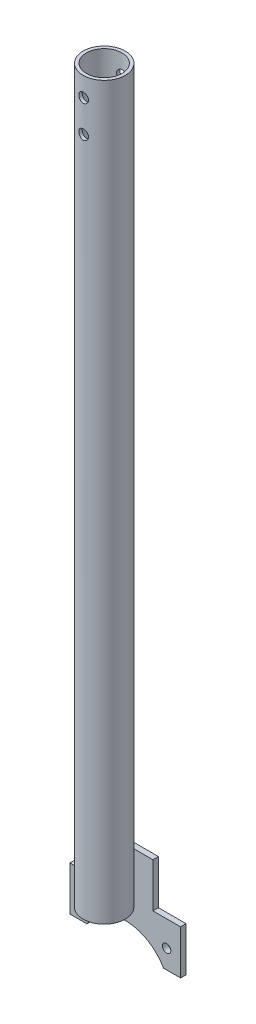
SolidWorks part; units mm, degrees
ref_plane "Front Plane" through (0, 0, 0) normal (0, 0, 1) x (1, 0, 0)
ref_plane "Top Plane" through (0, 0, 0) normal (0, 1, 0) x (1, 0, 0)
ref_plane "Right Plane" through (0, 0, 0) normal (1, 0, 0) x (0, 0, -1)
sketch "Sketch1" plane through (0, 0, 0) normal (0, 1, 0) x (1, 0, 0)
  circle A0 centre (0, 0) radius 24.13
  circle A1 centre (0, 0) radius 20.447
  dimension "D1" = 48.26
  dimension "D2" = 40.894
extrude "Extrude1" add sketch "Sketch1" along normal blind 838.2
ref_plane "Plane1" through (0, 0, -24.13) normal (0, 0, 1) x (1, 0, 0)
sketch "Sketch2" plane through (0, 0, -24.13) normal (0, 0, 1) x (1, 0, 0)
  line L0 (63.5, -50.8) -> (-63.5, -50.8)
  line L1 (-63.5, -50.8) -> (-63.5, 0)
  line L2 (-63.5, 0) -> (-31.75, 0)
  line L3 (-31.75, 0) -> (-31.75, 50.8)
  line L4 (-31.75, 50.8) -> (31.75, 50.8)
  line L5 (31.75, 50.8) -> (31.75, 0)
  line L6 (31.75, 0) -> (63.5, 0)
  line L7 (63.5, 0) -> (63.5, -50.8)
  dimension "D1" = 127
  dimension "D2" = 63.5
  dimension "D3" = 101.6
  dimension "D4" = 50.8
  dimension "D5" = 63.5
  dimension "D6" = 50.8
  dimension "D7" = 31.75
extrude "Extrude2" add sketch "Sketch2" against normal blind 6.35
sketch "Sketch3" plane through (0, 0, -24.13) normal (0, 0, 1) x (1, 0, 0)
  circle A0 centre (0, -76.2) radius 50.8
  dimension "D1" = 101.6
  dimension "D2" = 76.2
extrude "Cut-Extrude1" cut sketch "Sketch3" against normal through all
sketch "Sketch5" plane through (0, 0, -30.48) normal (0, 0, -1) x (-1, 0, 0)
  circle A0 centre (-47.4729, -29.3117) radius 4.826 construction
  circle A1 centre (-47.4729, -29.3117) radius 4.826
extrude "Cut-Extrude2" cut sketch "Sketch5" against normal through all
sketch "Sketch6" plane through (0, 0, -30.48) normal (0, 0, -1) x (-1, 0, 0)
  circle A0 centre (46.8198, -29.3038) radius 4.826 construction
  circle A1 centre (46.8198, -29.3038) radius 4.826
extrude "Cut-Extrude3" cut sketch "Sketch6" against normal through all
sketch "Sketch7" plane through (0, 0, -24.13) normal (0, 0, 1) x (1, 0, 0)
  line L0 (0, 838.2) -> (0, 0) construction
  line L1 (20.447, 838.2) -> (-20.447, 838.2) construction
  circle A0 centre (0, 815.975) radius 5.5499
  circle A1 centre (0, 779.4752) radius 5.5499
  dimension "D1" = 11.0998
  dimension "D2" = 22.225
  dimension "D3" = 36.4998
extrude "Cut-Extrude6" cut sketch "Sketch7" along normal through all
